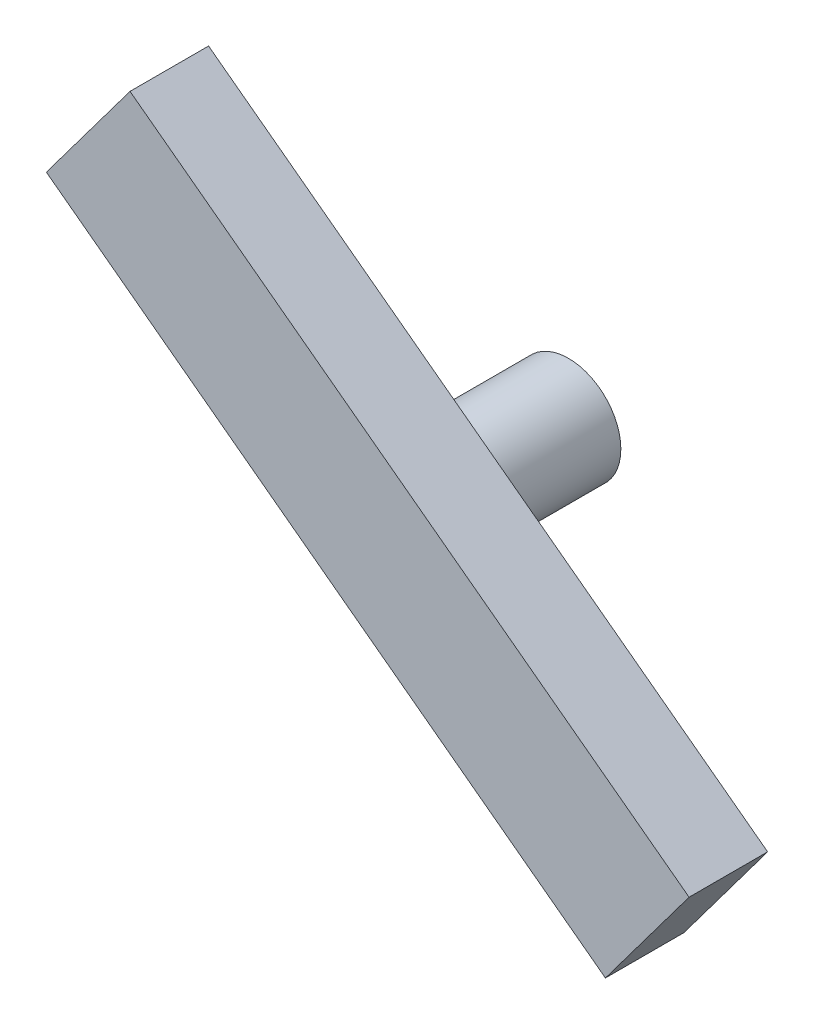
SolidWorks part; units mm, degrees
ref_plane "Alzado" through (0, 0, 0) normal (0, 0, 1) x (1, 0, 0)
ref_plane "Planta" through (0, 0, 0) normal (0, 1, 0) x (1, 0, 0)
ref_plane "Vista lateral" through (0, 0, 0) normal (1, 0, 0) x (0, 0, -1)
sketch3d "Sk_Vastago"
  line L0 (-263.1284, 316.5049, -22) -> (-263.1284, 316.5049, -15)
sweep "Vastago" add path "Sk_Vastago" parameters "D3"=6
sketch "Sk_Goma" plane through (0, 0, 0) normal (0, 0, 1) x (1, 0, 0)
  line L0 (-249.5118, 301.3198) -> (-244.7188, 307.725)
  line L1 (-244.7188, 307.725) -> (-276.7449, 331.6901)
  line L2 (-276.7449, 331.6901) -> (-281.538, 325.2848)
  line L3 (-281.538, 325.2848) -> (-249.5118, 301.3198)
extrude "Goma" add sketch "Sk_Goma" along normal blind 4.5 from offset 15
